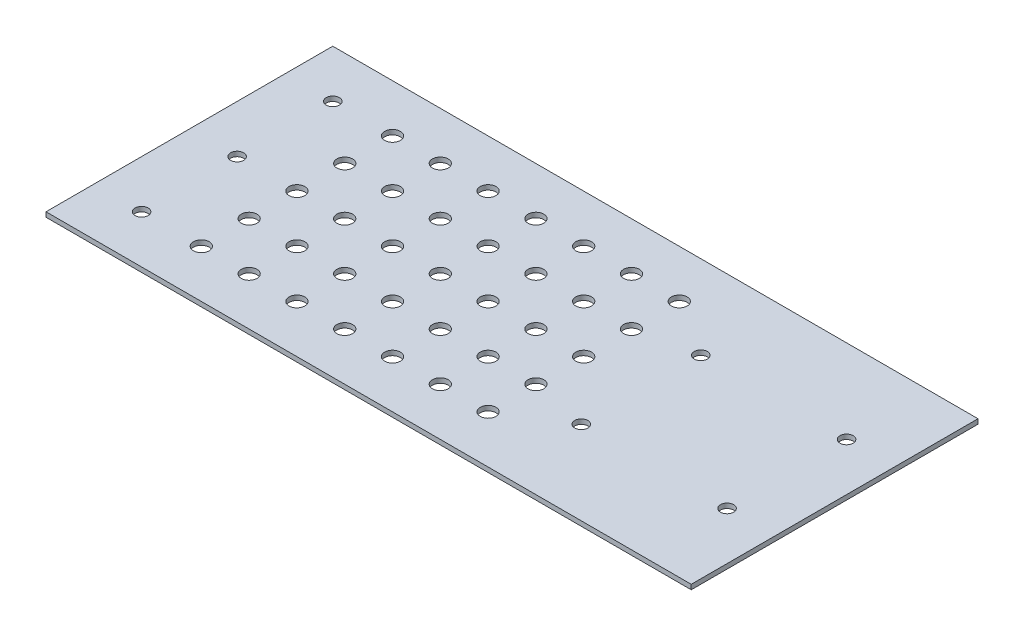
SolidWorks part; units mm, degrees
ref_plane "Front Plane" through (0, 0, 0) normal (0, 0, 1) x (1, 0, 0)
ref_plane "Top Plane" through (0, 0, 0) normal (0, 1, 0) x (1, 0, 0)
ref_plane "Right Plane" through (0, 0, 0) normal (1, 0, 0) x (0, 0, -1)
sketch "Sketch1" plane through (0, 0, 0) normal (0, 1, 0) x (1, 0, 0)
  line L1 (-135, -60) -> (135, -60)
  line L2 (-135, -60) -> (-135, 60)
  line L3 (-135, 60) -> (135, 60)
  line L4 (135, -60) -> (135, 60)
  line L5 (-135, -60) -> (135, 60) construction
  line L6 (-135, 60) -> (135, -60) construction
  point P0 (0, 0)
  dimension "D1" = 270
  dimension "D2" = 120
extrude "Boss-Extrude1" add sketch "Sketch1" along normal blind 2
sketch "Sketch2" plane through (0, 2, 0) normal (0, 1, 0) x (1, 0, 0)
  line L0 (0, 60) -> (0, -60) construction
  line L1 (135, 60) -> (-135, 60) construction
  line L2 (-135, -60) -> (135, -60) construction
  circle A0 centre (-115, -40) radius 2.75
  circle A1 centre (-115, 40) radius 2.75
  circle A2 centre (-115, 0) radius 2.75
  dimension "D1" = 5.5
  dimension "D4" = 5.5
  dimension "D7" = 5.5
  dimension "D2" = 115
  dimension "D3" = 20
  dimension "D5" = 115
  dimension "D6" = 20
extrude "Cut-Extrude1" cut sketch "Sketch2" against normal through all
sketch "Sketch3" plane through (0, 2, 0) normal (0, 1, 0) x (1, 0, 0)
  line L0 (-135, -60) -> (135, -60) construction
  line L1 (-135, 60) -> (-135, -60) construction
  circle A0 centre (-90, -40) radius 3.3
  circle A1 centre (-70, -40) radius 3.3
  circle A2 centre (-50, -40) radius 3.3
  circle A3 centre (-30, -40) radius 3.3
  circle A4 centre (-10, -40) radius 3.3
  circle A5 centre (10, -40) radius 3.3
  circle A6 centre (30, -40) radius 3.3
  circle A10 centre (-70, -20) radius 3.3
  circle A11 centre (-50, -20) radius 3.3
  circle A12 centre (-30, -20) radius 3.3
  circle A13 centre (-10, -20) radius 3.3
  circle A14 centre (10, -20) radius 3.3
  circle A15 centre (30, -20) radius 3.3
  circle A19 centre (-70, 0) radius 3.3
  circle A20 centre (-50, 0) radius 3.3
  circle A21 centre (-30, 0) radius 3.3
  circle A22 centre (-10, 0) radius 3.3
  circle A23 centre (10, 0) radius 3.3
  circle A24 centre (30, 0) radius 3.3
  circle A28 centre (-70, 20) radius 3.3
  circle A29 centre (-50, 20) radius 3.3
  circle A30 centre (-30, 20) radius 3.3
  circle A31 centre (-10, 20) radius 3.3
  circle A32 centre (10, 20) radius 3.3
  circle A33 centre (30, 20) radius 3.3
  circle A37 centre (-70, 40) radius 3.3
  circle A38 centre (-50, 40) radius 3.3
  circle A39 centre (-30, 40) radius 3.3
  circle A40 centre (-10, 40) radius 3.3
  circle A41 centre (10, 40) radius 3.3
  circle A42 centre (30, 40) radius 3.3
  circle A46 centre (-90, -20) radius 3.3
  circle A47 centre (-90, 0) radius 3.3
  circle A48 centre (-90, 20) radius 3.3
  circle A49 centre (-90, 40) radius 3.3
  dimension "D1" = 6.6
  dimension "D2" = 20
  dimension "D3" = 45
  dimension "D4" = 7
  dimension "D5" = 5
extrude "Cut-Extrude2" cut sketch "Sketch3" against normal blind 10
sketch "Sketch4" plane through (0, 2, 0) normal (0, 1, 0) x (1, 0, 0)
  line L0 (0, -60) -> (0, 60) construction
  line L1 (-135, -60) -> (135, -60) construction
  line L2 (135, 60) -> (-135, 60) construction
  circle A0 centre (115, 25) radius 2.75
  circle A1 centre (115, -25) radius 2.75
  circle A3 centre (54, 25) radius 2.75
  circle A4 centre (54, -25) radius 2.75
  dimension "D2" = 5.5
  dimension "D3" = 5.5
  dimension "D4" = 115
  dimension "D6" = 5.5
  dimension "D7" = 5.5
  dimension "D1" = 50
  dimension "D5" = 35
  dimension "D8" = 61
  dimension "D9" = 61
extrude "Cut-Extrude3" cut sketch "Sketch4" against normal blind 10
